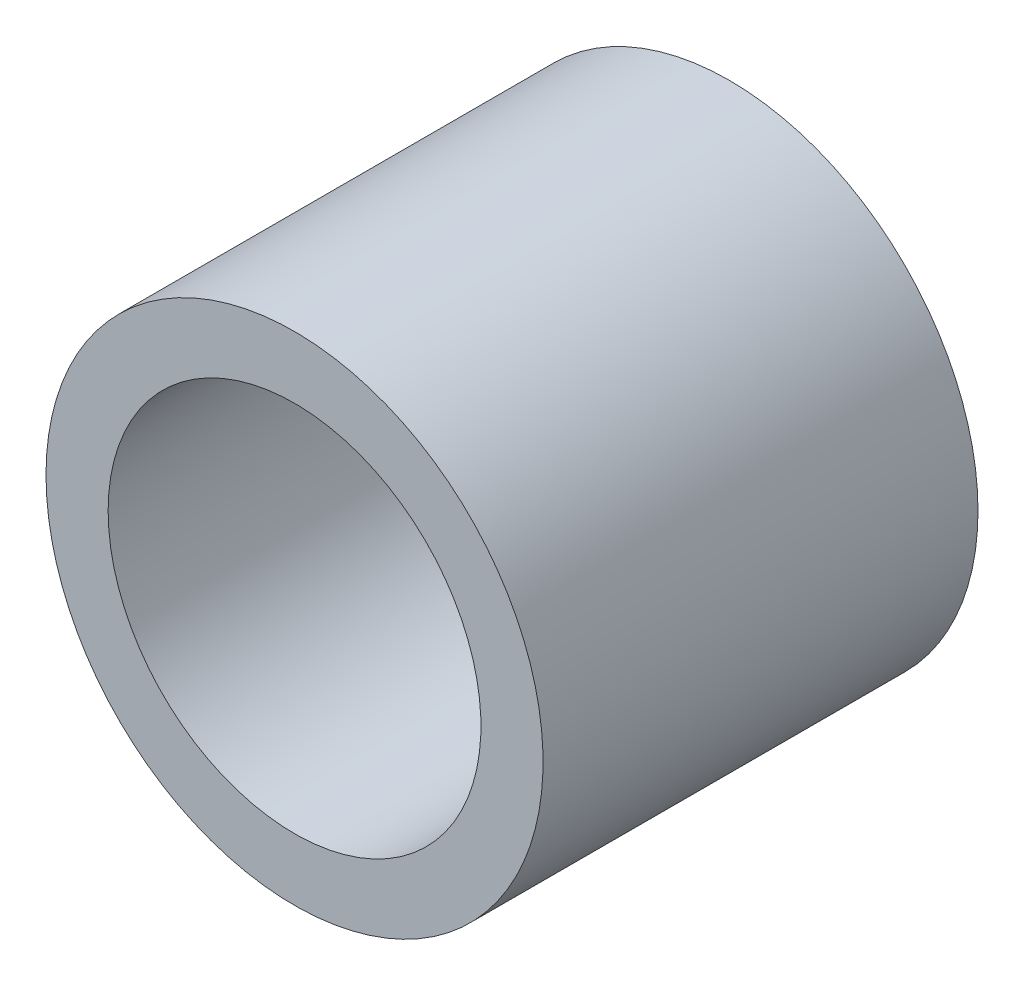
SolidWorks part; units mm, degrees
ref_plane "前视基准面" through (0, 0, 0) normal (0, 0, 1) x (1, 0, 0)
ref_plane "上视基准面" through (0, 0, 0) normal (0, 1, 0) x (1, 0, 0)
ref_plane "右视基准面" through (0, 0, 0) normal (1, 0, 0) x (0, 0, -1)
sketch "草图1" plane through (0, 0, 0) normal (0, 0, 1) x (1, 0, 0)
  circle A0 centre (-14.1569, 25) radius 3
  circle A1 centre (-14.1569, 25) radius 4
  dimension "D1" = 8
extrude "拉伸1" add sketch "草图1" along normal up to surface (7 mm away)
